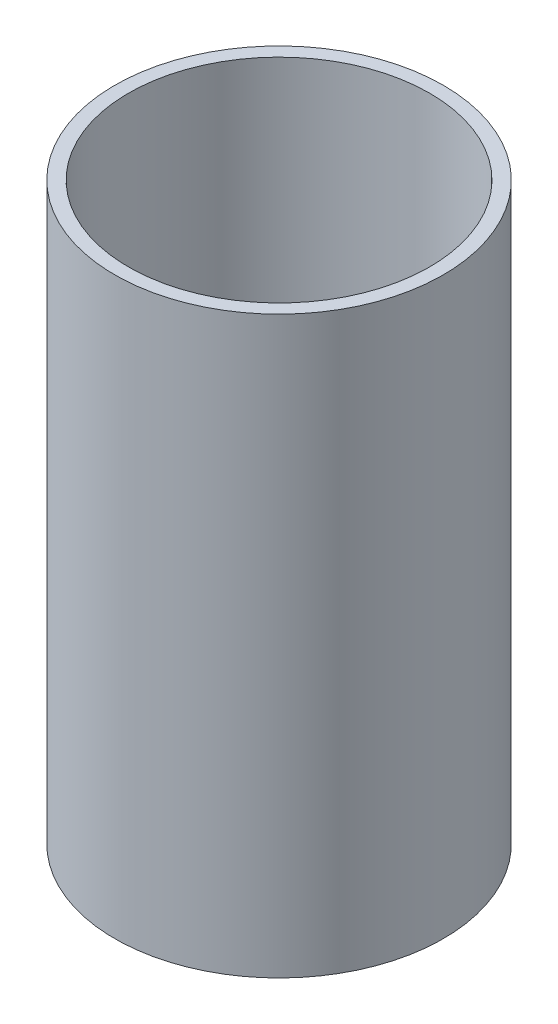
SolidWorks part; units mm, degrees
ref_plane "Front Plane" through (0, 0, 0) normal (0, 0, 1) x (1, 0, 0)
ref_plane "Top Plane" through (0, 0, 0) normal (0, 1, 0) x (1, 0, 0)
ref_plane "Right Plane" through (0, 0, 0) normal (1, 0, 0) x (0, 0, -1)
sketch "Sketch1" plane through (0, 0, 0) normal (0, 1, 0) x (1, 0, 0)
  circle A0 centre (0, 0) radius 11
  circle A1 centre (0, 0) radius 12
  dimension "D1" = 24
  dimension "D2" = 22
extrude "Boss-Extrude1" add sketch "Sketch1" along normal blind 42
